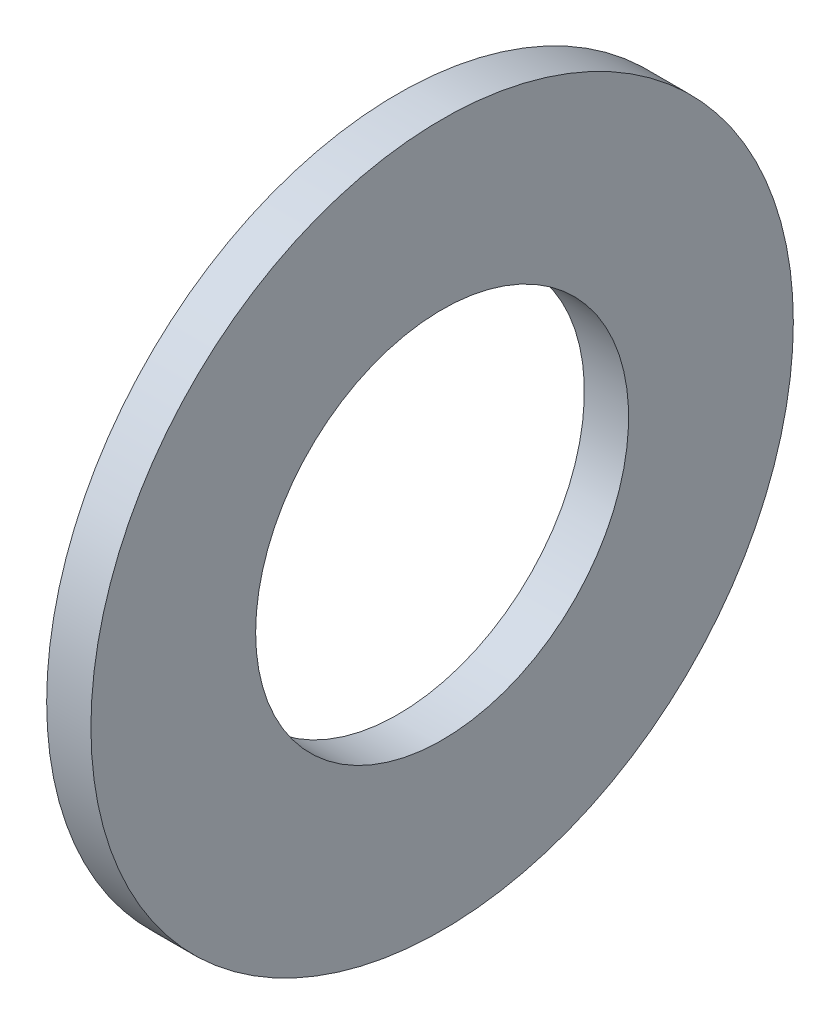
SolidWorks part; units mm, degrees
ref_plane "Plane1" through (0, 0, 0) normal (0, 0, 1) x (1, 0, 0)
ref_plane "Plane2" through (0, 0, 0) normal (0, 1, 0) x (1, 0, 0)
ref_plane "Plane3" through (0, 0, 0) normal (1, 0, 0) x (0, 0, -1)
revolve "Base-Revolve" add sketch "Sketch1" angle 360 about L0
sketch "Sketch1" plane through (0, 0, 0) normal (0, 0, 1) x (1, 0, 0)
  line L0 (-34.925, 0) -> (9.525, 0) construction
  line L1 (0, 6.7437) -> (0, 12.7)
  line L2 (0, 12.7) -> (-1.6002, 12.7)
  line L3 (-1.6002, 12.7) -> (-1.6002, 6.7437)
  line L4 (-1.6002, 6.7437) -> (0, 6.7437)
  dimension "Thickness" = 1.6002
  dimension "Inside_dia" = 13.4874
  dimension "Outside_dia" = 25.4
